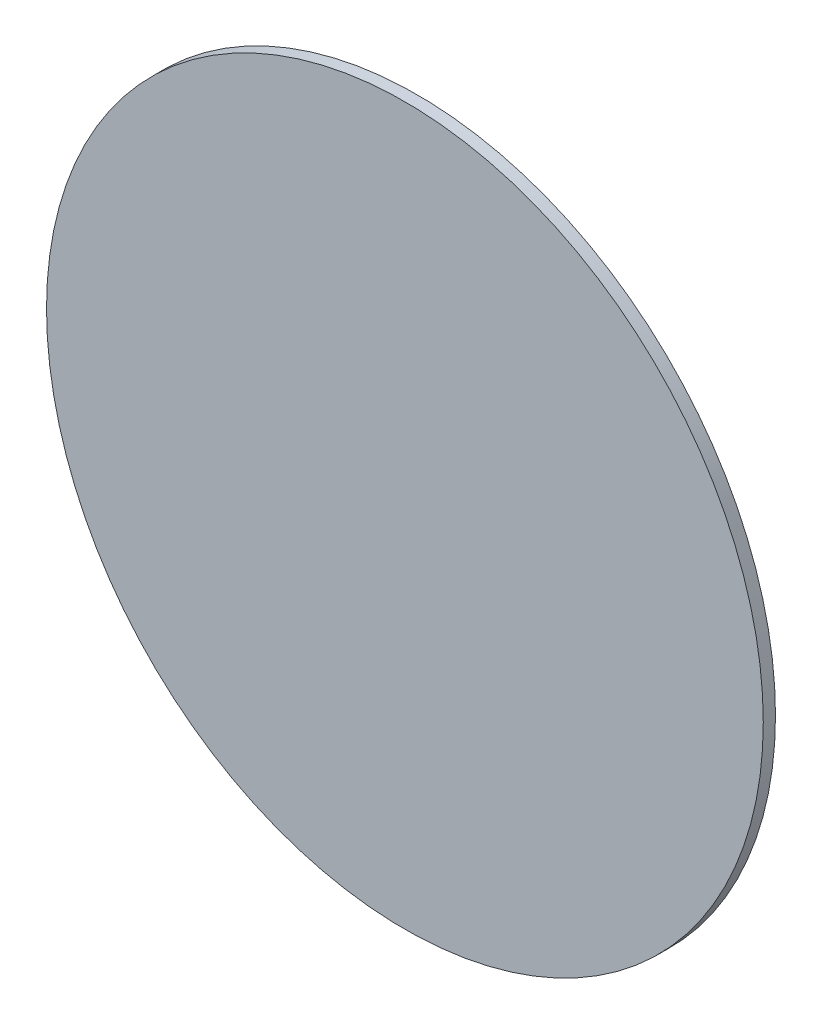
SolidWorks part; units mm, degrees
ref_plane "Front Plane" through (0, 0, 0) normal (0, 0, 1) x (1, 0, 0)
ref_plane "Top Plane" through (0, 0, 0) normal (0, 1, 0) x (1, 0, 0)
ref_plane "Right Plane" through (0, 0, 0) normal (1, 0, 0) x (0, 0, -1)
sketch "Sketch1" plane through (0, 0, 0) normal (1, 0, 0) x (0, 0, -1)
  line L0 (-3.9289, 0) -> (4.4222, 0) construction
  line L1 (0, 0) -> (0, 8.9535)
  line L2 (0, 8.9535) -> (0.3048, 8.9535)
  line L3 (0.3048, 8.9535) -> (0.3048, 5.3975)
  line L4 (0.3048, 5.3975) -> (0.889, 4.445)
  line L5 (0.889, 4.445) -> (0.889, 0)
  line L6 (0.889, 0) -> (0, 0)
  dimension "D1" = 0.3048
  dimension "D2" = 0.889
  dimension "D3" = 10.795
  dimension "D4" = 17.907
  dimension "D5" = 8.89
revolve "Revolve1" add sketch "Sketch1" angle 360 about L0
fillet "Fillet1" radius 0.635 2 edges at (4.445, 0, -0.889) (5.3975, 0, -0.3048)
